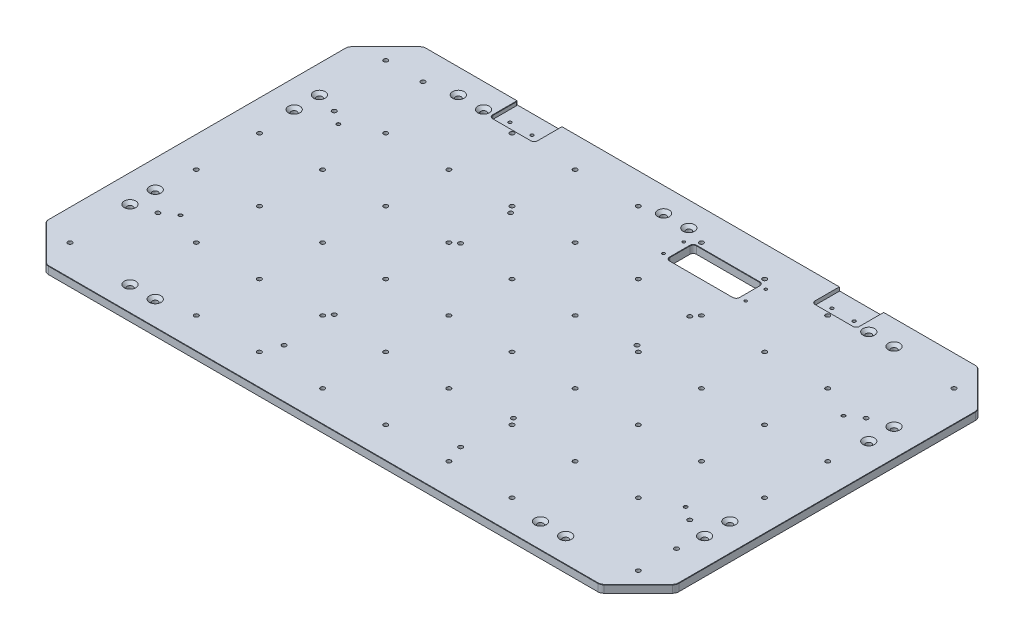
SolidWorks part; units mm, degrees
ref_plane "Ebene vorne" through (0, 0, 0) normal (0, 0, 1) x (1, 0, 0)
ref_plane "Ebene oben" through (0, 0, 0) normal (0, 1, 0) x (1, 0, 0)
ref_plane "Ebene rechts" through (0, 0, 0) normal (1, 0, 0) x (0, 0, -1)
sketch "Skizze1" plane through (0, 0, 0) normal (0, 1, 0) x (1, 0, 0)
  line L0 (-439, 299) -> (-499, 239)
  line L1 (-439, -299) -> (439, -299)
  line L2 (-439, -299) -> (-439, 299) construction
  line L3 (-439, 299) -> (439, 299)
  line L4 (439, -299) -> (439, 299) construction
  line L5 (-439, -299) -> (439, 299) construction
  line L6 (-439, 299) -> (439, -299) construction
  line L7 (-499, 239) -> (-499, -239)
  line L8 (-439, -299) -> (-499, -239)
  line L10 (439, -299) -> (499, -239)
  line L11 (499, -239) -> (499, 239)
  line L12 (499, 239) -> (439, 299)
  line L13 (-499, 0) -> (0, 0) construction
  point P0 (0, 0)
  dimension "D1" = 998
  dimension "D2" = 598
  dimension "D3" = 60
  dimension "D4" = 45
extrude "Aufsatz-Linear austragen1" add sketch "Skizze1" along normal blind 12
fillet "Verrundung1" radius 10 8 edges at (499, 6, 239) (439, 6, 299) (-439, 6, 299) (-499, 6, 239) (-499, 6, -239) (-439, 6, -299) (499, 6, -239) (439, 6, -299)
hole_wizard "Stirnsenkung für M6 Zylinderschraube mit Innensechskant1" positions "Skizze2" profile "Skizze3" counterbore size "M6" standard "DIN"
sketch "Skizze2" plane through (0, 15, 0) normal (0, 1, 0) x (1, 0, 0)
  line L1 (270, -260) -> (-270, -260)
  line L2 (270, -260) -> (270, 260)
  line L3 (270, 260) -> (-270, 260)
  line L4 (-270, -260) -> (-270, 260)
  line L5 (270, -260) -> (-270, 260) construction
  line L6 (270, 260) -> (-270, -260) construction
  line L7 (0, 0) -> (-610.081, 0) construction
  line L8 (-455, 125) -> (-455, -125) construction
  line L9 (-455, -125) -> (-345, -125) construction
  line L10 (-345, -125) -> (-345, 125) construction
  line L11 (-345, 125) -> (-455, 125) construction
  line L13 (0, 0) -> (0, -385.3386) construction
  line L15 (345, 125) -> (455, 125) construction
  line L16 (345, -125) -> (345, 125) construction
  line L17 (455, -125) -> (345, -125) construction
  line L18 (455, 125) -> (455, -125) construction
  point P2 (-270, 260)
  point P5 (270, -260)
  point P6 (270, 260)
  point P7 (-270, -260)
  point P83 (0, 260)
  point P91 (0, -260)
  point P98 (-455, 125)
  point P100 (-455, -125)
  point P102 (-345, -125)
  point P104 (-345, 125)
  point P122 (345, 125)
  point P123 (455, 125)
  point P124 (345, -125)
  point P125 (455, -125)
  dimension "D1" = 540
  dimension "D2" = 520
  dimension "D3" = 690
  dimension "D4" = 910
  dimension "D5" = 250
sketch "Skizze3" plane through (-270, 15, -260) normal (1, 0, 0) x (0, 0, 1)
  line L0 (0, 0) -> (0, 15)
  line L1 (0, 15) -> (3.3, 15)
  line L3 (3.3, 15) -> (3.3, 4.4)
  line L4 (3.3, 4.4) -> (5.5, 4.4)
  line L5 (5.5, 4.4) -> (5.5, 0)
  line L7 (5.5, 0) -> (0, 0)
  line L11 (0, -6.35) -> (0, 107.95) construction
  dimension "Bohrerdurchmesser" = 6.6
  dimension "Bohrungstiefe" = 15
  dimension "Senkdurchmesser2" = 11
  dimension "Senktiefe2" = 4.4
hole_wizard "M8 Gewindebohrung1" positions "Skizze4" profile "Skizze5" tap size "M8" standard "DIN"
sketch "Skizze4" plane through (0, 12, 0) normal (0, 1, 0) x (1, 0, 0)
  line L0 (-434.8579, -299) -> (434.8579, -299) construction
  line L1 (0, -81.5) -> (-197.5, -81.5) construction
  line L2 (-197.5, -81.5) -> (0, 116) construction
  line L3 (0, 116) -> (197.5, -81.5) construction
  line L4 (197.5, -81.5) -> (0, -279) construction
  line L5 (0, -279) -> (-197.5, -81.5) construction
  line L7 (-139.6536, -221.1536) -> (139.6536, 58.1536) construction
  line L8 (-139.6536, 58.1536) -> (139.6536, -221.1536) construction
  circle A0 centre (0, -81.5) radius 197.5 construction
  point P21 (-139.6536, -221.1536)
  point P22 (139.6536, 58.1536)
  point P23 (-139.6536, 58.1536)
  point P24 (139.6536, -221.1536)
  dimension "D1" = 395
  dimension "D2" = 20
sketch "Skizze5" plane through (139.6536, 12, 221.1536) normal (1, 0, 0) x (0, 0, 1)
  line L0 (0, 0) -> (0, 12)
  line L1 (0, 12) -> (3.4, 12)
  line L2 (3.4, 12) -> (3.4, 0)
  line L5 (3.4, 0) -> (0, 0)
  line L11 (0, -6.35) -> (0, 107.95) construction
  dimension "Bohrerdurchmesser" = 6.8
  dimension "Bohrungstiefe" = 12
hole_wizard "M8 Gewindebohrung2" positions "Skizze6" profile "Skizze7" tap size "M8" standard "DIN"
sketch "Skizze6" plane through (0, 12, 0) normal (0, 1, 0) x (1, 0, 0)
  line L1 (141.8464, -139.6536) -> (421.1536, -139.6536) construction
  line L2 (141.8464, -139.6536) -> (141.8464, 139.6536) construction
  line L3 (141.8464, 139.6536) -> (421.1536, 139.6536) construction
  line L4 (421.1536, -139.6536) -> (421.1536, 139.6536) construction
  line L5 (141.8464, -139.6536) -> (421.1536, 139.6536) construction
  line L6 (141.8464, 139.6536) -> (421.1536, -139.6536) construction
  line L7 (499, -234.8579) -> (499, 234.8579) construction
  circle A0 centre (281.5, 0) radius 197.5 construction
  point P5 (421.1536, 139.6536)
  point P8 (141.8464, -139.6536)
  point P9 (141.8464, 139.6536)
  point P10 (421.1536, -139.6536)
  dimension "D1" = 395
  dimension "D2" = 20
sketch "Skizze7" plane through (421.1536, 12, 139.6536) normal (1, 0, 0) x (0, 0, 1)
  line L0 (0, 0) -> (0, 12)
  line L1 (0, 12) -> (3.4, 12)
  line L2 (3.4, 12) -> (3.4, 0)
  line L5 (3.4, 0) -> (0, 0)
  line L11 (0, -6.35) -> (0, 107.95) construction
  dimension "Bohrerdurchmesser" = 6.8
  dimension "Bohrungstiefe" = 12
hole_wizard "M8 Gewindebohrung3" positions "Skizze9" profile "Skizze10" tap size "M8" standard "DIN"
sketch "Skizze9" plane through (0, 12, 0) normal (0, 1, 0) x (1, 0, 0)
  point P0 (-450, -250)
  dimension "D1" = 450
  dimension "D2" = 250
sketch "Skizze10" plane through (-450, 12, 250) normal (1, 0, 0) x (0, 0, 1)
  line L0 (0, 0) -> (0, 12)
  line L1 (0, 12) -> (3.4, 12)
  line L2 (3.4, 12) -> (3.4, 0)
  line L5 (3.4, 0) -> (0, 0)
  line L11 (0, -6.35) -> (0, 107.95) construction
  dimension "Bohrerdurchmesser" = 6.8
  dimension "Bohrungstiefe" = 12
pattern_linear "Lineares Muster1" count 10 spacing 100 along (1, 0, 0) count 6 spacing 100 along (0, 0, -1) of "M8 Gewindebohrung3"
sketch "Skizze8" plane through (0, 12, 0) normal (0, 1, 0) x (1, 0, 0)
  line L1 (50, 200) -> (150, 200)
  line L2 (45, 205) -> (45, 237)
  line L3 (50, 242) -> (150, 242)
  line L4 (155, 205) -> (155, 237)
  line L5 (45, 200) -> (155, 242) construction
  line L6 (45, 242) -> (155, 200) construction
  arc A0 (45, 205) -> (50, 200) centre (50, 205) ccw
  arc A1 (150, 200) -> (155, 205) centre (150, 205) ccw
  arc A2 (155, 237) -> (150, 242) centre (150, 237) ccw
  arc A3 (50, 242) -> (45, 237) centre (50, 237) ccw
  point P0 (100, 221)
  dimension "D5" = 5
  dimension "D1" = 100
  dimension "D2" = 110
  dimension "D3" = 42
  dimension "D4" = 221
extrude "Schnitt-Linear austragen1" cut sketch "Skizze8" against normal through all
hole_wizard "M5 Gewindebohrung1" positions "Skizze20" profile "Skizze21" tap size "M5" standard "DIN"
sketch "Skizze20" plane through (0, 12, 0) normal (0, 1, 0) x (1, 0, 0)
  line L0 (100, 242) -> (100, 200) construction
  line L1 (150, 242) -> (50, 242) construction
  line L2 (50, 200) -> (150, 200) construction
  line L4 (45, 221) -> (155, 221) construction
  line L5 (45, 237) -> (45, 205) construction
  line L6 (155, 205) -> (155, 237) construction
  point P16 (35, 237)
  point P18 (35, 205)
  point P20 (165, 205)
  point P22 (165, 237)
  dimension "D1" = 32
  dimension "D2" = 130
sketch "Skizze21" plane through (165, 12, -237) normal (1, 0, 0) x (0, 0, 1)
  line L0 (0, 0) -> (0, 13.2618)
  line L1 (0, 13.2618) -> (2.1, 12)
  line L2 (2.1, 12) -> (2.1, 0)
  line L5 (2.1, 0) -> (0, 0)
  line L10 (0, 13.2618) -> (-2.1, 12) construction
  line L11 (0, -6.35) -> (0, 107.95) construction
  dimension "Bohrerdurchmesser" = 4.2
  dimension "Bohrungstiefe" = 12
  dimension "Spitzenwinkel" = 118
sketch "Skizze11" plane through (0, 12, 0) normal (0, 1, 0) x (1, 0, 0)
  line L0 (0, 0) -> (0, 349.1689) construction
  line L1 (434.8579, 299) -> (-434.8579, 299) construction
  line L2 (-255, 299) -> (-255, 255) construction
  line L3 (-290.1, 299) -> (-219.9, 299)
  line L4 (-290.1, 299) -> (-290.1, 260)
  line L5 (-285.1, 255) -> (-224.9, 255)
  line L6 (-219.9, 299) -> (-219.9, 260)
  line L7 (219.9, 299) -> (219.9, 260)
  line L8 (285.1, 255) -> (224.9, 255)
  line L9 (290.1, 299) -> (290.1, 260)
  line L10 (290.1, 299) -> (219.9, 299)
  arc A0 (-219.9, 260) -> (-224.9, 255) centre (-224.9, 260) cw
  arc A1 (-285.1, 255) -> (-290.1, 260) centre (-285.1, 260) cw
  arc A2 (285.1, 255) -> (290.1, 260) centre (285.1, 260) ccw
  arc A3 (219.9, 260) -> (224.9, 255) centre (224.9, 260) ccw
  point P12 (-219.9, 255)
  point P15 (-290.1, 255)
  point P25 (290.1, 255)
  point P26 (219.9, 255)
  dimension "D3" = 5
  dimension "D1" = 44
  dimension "D2" = 70.2
  dimension "D4" = 255
extrude "Schnitt-Linear austragen2" cut sketch "Skizze11" against normal blind 6
fillet "Verrundung2" radius 2 2 edges at (-219.9, 9, -299) (-290.1, 9, -299)
hole_wizard "M6 Gewindebohrung1" positions "Skizze12" profile "Skizze13" tap size "M6" standard "DIN"
sketch "Skizze12" plane through (0, 6, 0) normal (0, 1, 0) x (1, 0, 0)
  line L0 (-255, 0) -> (-255, 269.2) construction
  line L1 (-255, 269.2) -> (-272.5, 269.2) construction
  line L3 (-255, 269.2) -> (-237.5, 269.2) construction
  line L6 (-285.1, 255) -> (-224.9, 255) construction
  line L7 (-290.1, 297) -> (-290.1, 260) construction
  line L8 (-219.9, 260) -> (-219.9, 297) construction
  line L9 (0, 0) -> (0, 376.4812) construction
  point P0 (-272.5, 269.2)
  point P4 (-237.5, 269.2)
  point P36 (237.5, 269.2)
  point P37 (272.5, 269.2)
  dimension "D1" = 35
  dimension "D2" = 14.2
sketch "Skizze13" plane through (-272.5, 6, -269.2) normal (1, 0, 0) x (0, 0, 1)
  line L0 (0, 0) -> (0, 6)
  line L1 (0, 6) -> (2.5, 6)
  line L2 (2.5, 6) -> (2.5, 0)
  line L5 (2.5, 0) -> (0, 0)
  line L11 (0, -6.35) -> (0, 107.95) construction
  dimension "Bohrerdurchmesser" = 5
  dimension "Bohrungstiefe" = 6
mirror "Spiegeln1" about plane through (0, 0, 0) normal (1, 0, 0) of "M8 Gewindebohrung2"
hole_wizard "Ø5.0mm Stiftloch1" positions "Skizze14" profile "Skizze15" hole size "Ø5.0" standard "DIN"
sketch "Skizze14" plane through (0, 12, 0) normal (0, 1, 0) x (1, 0, 0)
  line L0 (0, 372.3056) -> (0, 0) construction
  line L1 (0, 0) -> (588.4679, 0) construction
  point P8 (400, 125)
  point P10 (400, -125)
  point P12 (-400, 125)
  point P14 (-400, -125)
  dimension "D1" = 250
  dimension "D2" = 800
sketch "Skizze15" plane through (-400, 12, 125) normal (1, 0, 0) x (0, 0, 1)
  line L0 (0, 0) -> (0, 9.5022)
  line L1 (0, 9.5022) -> (2.5, 8)
  line L2 (2.5, 8) -> (2.5, 0.25)
  line L3 (2.5, 0.25) -> (2.75, 0)
  line L5 (2.75, 0) -> (0, 0)
  line L6 (-2.5, 0.25) -> (-2.75, 0) construction
  line L10 (0, 9.5022) -> (-2.5, 8) construction
  line L11 (0, -6.35) -> (0, 107.95) construction
  dimension "Bohrerdurchmesser" = 5
  dimension "Bohrungstiefe" = 8
  dimension "Senkdurchmesser2 (Oben)" = 5.5
  dimension "Senkwinkel2 (Oben)" = 90
  dimension "Spitzenwinkel" = 118
chamfer "Fase1" distance 0.5 angle 45 25 edges at (-255, 12, -255) (-288.6355, 12, -256.4645) (-221.3645, 12, -256.4645) (-290.1, 12, -278.5) (-219.9, 12, -278.5) (-290.6858, 12, -298.4142) (-219.3142, 12, -298.4142) (-363.4789, 12, -299) (1, 12, -299) (362.4789, 12, -299) (-438.6847, 12, -298.2388) (438.6847, 12, -298.2388) (-469, 12, -269) (469, 12, -269) (-498.2388, 12, -238.6847) (498.2388, 12, -238.6847) (-499, 12, 0) (499, 12, 0) (-498.2388, 12, 238.6847) (498.2388, 12, 238.6847) (-469, 12, 269) (469, 12, 269) (-438.6847, 12, 298.2388) (438.6847, 12, 298.2388) (0, 12, 299)
chamfer "Fase2" distance 0.5 angle 45 8 edges at (100, 12, -200) (153.5355, 12, -201.4645) (46.4645, 12, -201.4645) (155, 12, -221) (45, 12, -221) (153.5355, 12, -240.5355) (46.4645, 12, -240.5355) (100, 12, -242)
sketch "Skizze22" plane through (0, 12, 0) normal (0, 1, 0) x (1, 0, 0)
  line L0 (0, 382.0878) -> (0, 0) construction
  line L1 (0, 0) -> (589.605, 0) construction
  circle A0 centre (350, -250) radius 5
  circle A1 centre (450, -150) radius 5
  circle A2 centre (350, 250) radius 5
  circle A3 centre (450, 150) radius 5
  circle A4 centre (-450, 150) radius 5
  circle A5 centre (-350, 250) radius 5
  circle A6 centre (-450, -150) radius 5
  circle A7 centre (-350, -250) radius 5
  dimension "D1" = 10
extrude "Aufsatz-Linear austragen2" add sketch "Skizze22" against normal up to surface (12 mm away)
hole_wizard "Formsenkung für M8 Senkschraube mit Innensechskant1" positions "Skizze18" profile "Skizze19" countersink size "M8" standard "DIN"
sketch "Skizze18" plane through (0, 12, 0) normal (0, 1, 0) x (1, 0, 0)
  line L1 (-345, -260) -> (345, -260)
  line L2 (-345, -260) -> (-345, 260)
  line L3 (-345, 260) -> (345, 260)
  line L4 (345, -260) -> (345, 260)
  line L5 (-345, -260) -> (345, 260) construction
  line L6 (-345, 260) -> (345, -260) construction
  line L7 (-455, 150) -> (-455, 110) construction
  line L8 (-455, 110) -> (-455, -110) construction
  line L9 (-455, -110) -> (-455, -150) construction
  line L11 (-455, 0) -> (0, 0) construction
  line L12 (0, 0) -> (0, 327.7572) construction
  line L14 (455, -110) -> (455, -150) construction
  line L15 (455, 110) -> (455, -110) construction
  line L16 (455, 150) -> (455, 110) construction
  point P2 (345, 260)
  point P5 (-345, -260)
  point P6 (-345, 260)
  point P7 (345, -260)
  point P140 (305, 260)
  point P143 (305, -260)
  point P145 (-305, -260)
  point P147 (-305, 260)
  point P150 (-455, 150)
  point P151 (-455, 110)
  point P153 (-455, -110)
  point P155 (-455, -150)
  point P182 (455, 150)
  point P185 (455, 110)
  point P188 (455, -110)
  point P191 (455, -150)
  point P192 (-20, 260)
  point P194 (20, 260)
  dimension "D1" = 520
  dimension "D2" = 690
  dimension "D3" = 40
  dimension "D4" = 40
  dimension "D5" = 40
  dimension "D6" = 40
  dimension "D7" = 110
  dimension "D8" = 40
  dimension "D9" = 300
  dimension "D10" = 40
sketch "Skizze19" plane through (345, 12, -260) normal (1, 0, 0) x (0, 0, 1)
  line L0 (0, 0) -> (0, 12)
  line L1 (0, 12) -> (4.5, 12)
  line L2 (4.5, 12) -> (4.5, 4.625)
  line L3 (4.5, 4.625) -> (9.125, 0)
  line L5 (9.125, 0) -> (0, 0)
  line L6 (-4.5, 4.625) -> (-9.125, 0) construction
  line L11 (0, -6.35) -> (0, 107.95) construction
  dimension "Bohrerdurchmesser" = 9
  dimension "Bohrungstiefe" = 12
  dimension "Senkdurchmesser (Oben)" = 18.25
  dimension "Senkwinkel (Oben)" = 90
hole_wizard "M8 Gewindebohrung4" positions "Skizze23" profile "Skizze24" tap size "M8" standard "DIN"
sketch "Skizze23" plane through (0, 12, 0) normal (0, 1, 0) x (1, 0, 0)
  line L0 (-450, 250) -> (-362.0783, 250) construction
  line L2 (450, -250) -> (450, -177.4247) construction
  point P0 (-391, 250)
  point P14 (450, -189.5)
  dimension "D1" = 59
  dimension "D2" = 60.5
sketch "Skizze24" plane through (-391, 12, -250) normal (1, 0, 0) x (0, 0, 1)
  line L0 (0, 0) -> (0, 12)
  line L1 (0, 12) -> (3.4, 12)
  line L2 (3.4, 12) -> (3.4, 0)
  line L5 (3.4, 0) -> (0, 0)
  line L11 (0, -6.35) -> (0, 107.95) construction
  dimension "Nenndurchmesser (Haupt)" = 6.8
  dimension "Bohrungstiefe" = 12
